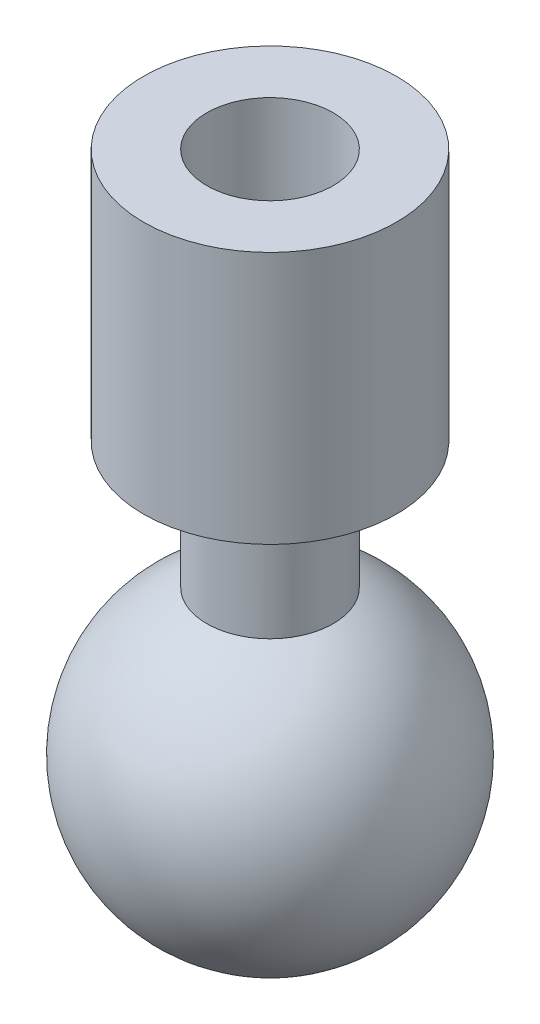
SolidWorks part; units mm, degrees
ref_plane "Front Plane" through (0, 0, 0) normal (0, 0, 1) x (1, 0, 0)
ref_plane "Top Plane" through (0, 0, 0) normal (0, 1, 0) x (1, 0, 0)
ref_plane "Right Plane" through (0, 0, 0) normal (1, 0, 0) x (0, 0, -1)
sketch "Sketch1" plane through (0, 0, 0) normal (0, 0, 1) x (1, 0, 0)
  line L0 (0, 0) -> (0, 7.7913) construction
  line L1 (0, 10.7913) -> (1, 10.7913) construction
  line L3 (0, 0) -> (0, 7.7913)
  line L4 (0, 7.7913) -> (1, 7.7913)
  line L6 (1, 10.7913) -> (1, 7.7913)
  line L7 (1, 6.7913) -> (2, 6.7913)
  line L8 (2, 10.7913) -> (2, 6.7913)
  line L9 (1, 7.7913) -> (1, 6.7913) construction
  line L10 (1, 6.7913) -> (1, 4.7913)
  line L11 (1, 7.7913) -> (1, 6.7913) construction
  line L12 (0, 7.7913) -> (0, 10.7913) construction
  line L13 (0, 10.7913) -> (0, 15.7259) construction
  line L14 (0, 7.7913) -> (0, 10.7913) construction
  line L15 (2, 10.7913) -> (1, 10.7913)
  arc A0 (0, 0) -> (1, 4.7913) centre (0, 2.5) ccw
  arc A1 (1, 4.7913) -> (0, 5) centre (0, 2.5) ccw construction
  dimension "D1" = 2.5
  dimension "D2" = 1
  dimension "D3" = 6
  dimension "D4" = 4
  dimension "D5" = 2
  dimension "D6" = 1
revolve "Revolve1" add sketch "Sketch1" angle 360 about L0
